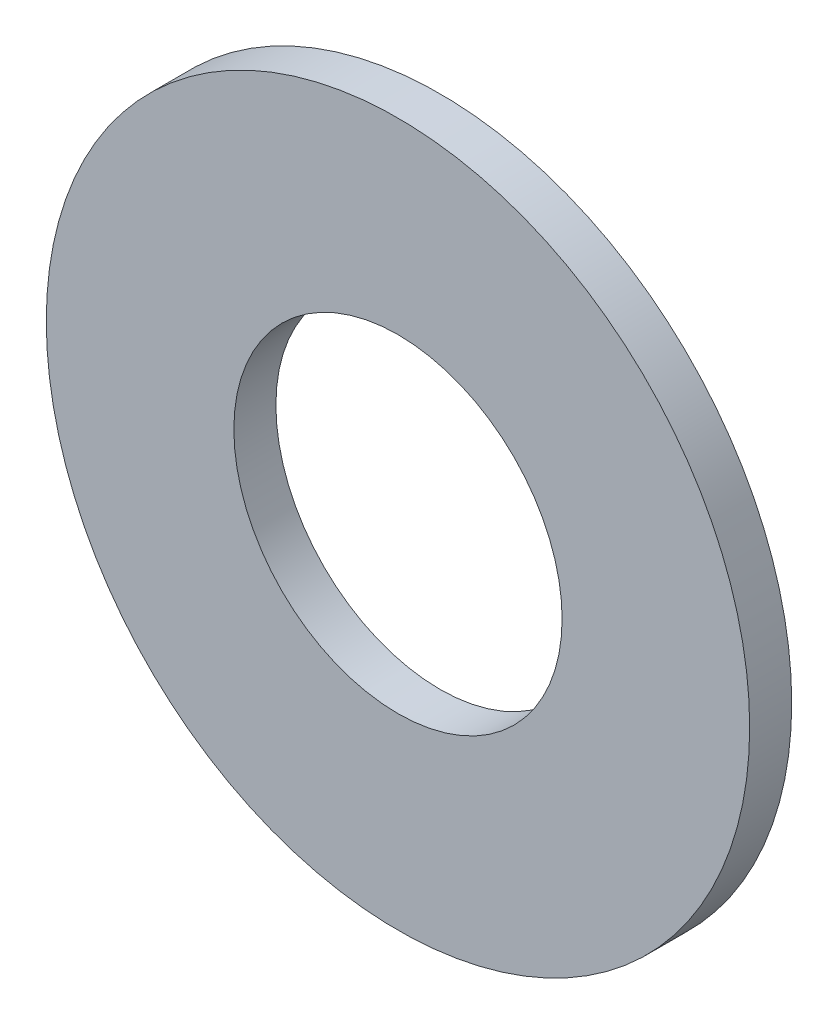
SolidWorks part; units mm, degrees
ref_plane "Plane1" through (0, 0, 0) normal (0, 0, 1) x (1, 0, 0)
ref_plane "Plane2" through (0, 0, 0) normal (0, 1, 0) x (1, 0, 0)
ref_plane "Plane3" through (0, 0, 0) normal (1, 0, 0) x (0, 0, -1)
sketch "Sketch1" plane through (0, 0, 0) normal (0, 0, 1) x (1, 0, 0)
  circle A0 centre (0, 0) radius 11.049
  circle A1 centre (0, 0) radius 5.1562
  dimension "D1" = 10.3124
  dimension "D2" = 22.098
extrude "Base-Extrude" add sketch "Sketch1" along normal blind 1.3208
